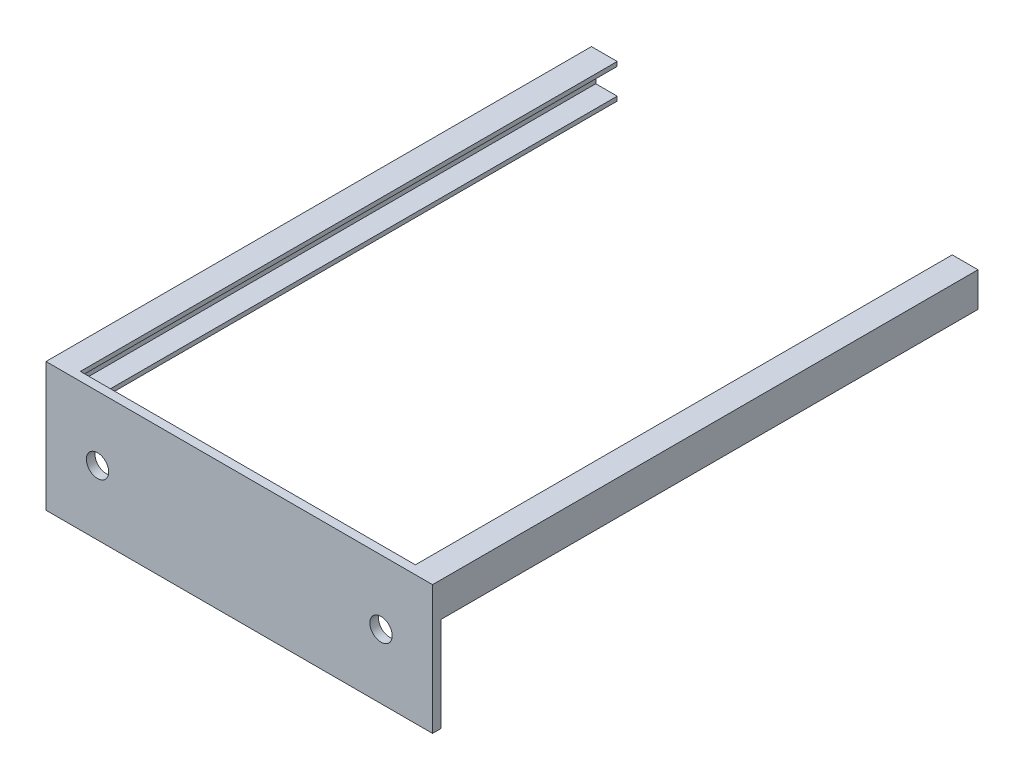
SolidWorks part; units mm, degrees
ref_plane "Piano frontale" through (0, 0, 0) normal (0, 0, 1) x (1, 0, 0)
ref_plane "Piano superiore" through (0, 0, 0) normal (0, 1, 0) x (1, 0, 0)
ref_plane "Piano destro" through (0, 0, 0) normal (1, 0, 0) x (0, 0, -1)
sketch "Schizzo1" plane through (0, 0, 0) normal (0, 0, 1) x (1, 0, 0)
  line L0 (0, 0) -> (-6, 0)
  line L1 (-6, 0) -> (-6, 8)
  line L2 (0, 0) -> (0, 1)
  line L3 (0, 1) -> (-5, 1)
  line L4 (-5, 1) -> (-5, 7)
  line L6 (-5, 7) -> (0, 7)
  line L7 (0, 7) -> (0, 8)
  line L8 (0, 8) -> (-6, 8)
  dimension "D1" = 8
  dimension "D2" = 1
  dimension "D3" = 1
  dimension "D4" = 1
  dimension "D5" = 5
extrude "Estrusione-Estrusione1" add sketch "Schizzo1" along normal blind 125
sketch "Schizzo2" plane through (0, 0, 125) normal (0, 0, 1) x (1, 0, 0)
  line L1 (-6, 8) -> (84, 8)
  line L2 (-6, 8) -> (-6, -22)
  line L3 (-6, -22) -> (84, -22)
  line L4 (84, 8) -> (84, -22)
  dimension "D1" = 90
  dimension "D2" = 30
extrude "Estrusione-Estrusione2" add sketch "Schizzo2" along normal blind 2 contours L1 L4 L3 L2
ref_plane "Piano1" through (39, 0, 0) normal (1, 0, 0) x (0, 0, -1)
hole_wizard "Foro Ø5.2 (5.2)-1" positions "Schizzo3D2" profile "Schizzo3" hole size "Ø5.2" standard "ISO"
sketch3d "Schizzo3D2"
  line L0 (-6, -22, 127) -> (84, -22, 127) construction
  line L1 (-6, 8, 127) -> (-6, -22, 127) construction
  point P0 (6, -7, 127)
  point P8 (-11.8751, -62.9938, 0)
  point P10 (-11.0489, -62.164, 0)
  point P12 (-20.4362, -60.5577, 0)
  dimension "D1" = 15
  dimension "D2" = 12
sketch "Schizzo3" plane through (6, -7, 127) normal (1, 0, 0) x (0, -1, 0)
  line L0 (0, 0) -> (0, 2)
  line L1 (0, 2) -> (2.6, 2)
  line L2 (2.6, 2) -> (2.6, 0)
  line L5 (2.6, 0) -> (0, 0)
  line L11 (0, -6.35) -> (0, 107.95) construction
  dimension "Thru Hole Dia." = 5.2
  dimension "Thru Hole Depth" = 2
mirror "Specchia1" about plane through (39, 0, 0) normal (1, 0, 0) of "Foro Ø5.2 (5.2)-1", "Estrusione-Estrusione1"
